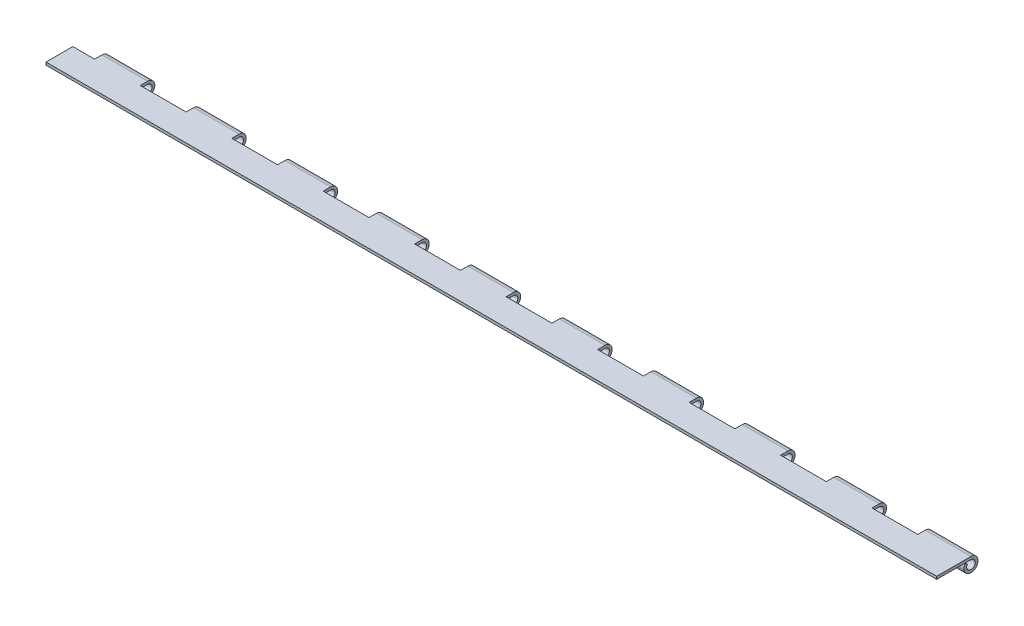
SolidWorks part; units mm, degrees
ref_plane "Front" through (0, 0, 0) normal (0, 0, 1) x (1, 0, 0)
ref_plane "Top" through (0, 0, 0) normal (0, 1, 0) x (1, 0, 0)
ref_plane "Right" through (0, 0, 0) normal (1, 0, 0) x (0, 0, -1)
sketch "Sketch1" plane through (0, 0, 0) normal (1, 0, 0) x (0, 0, -1)
  line L0 (-4.0946, 2.4711) -> (-6.7042, 4.046)
  line L1 (-6.2004, 4.7825) -> (0, 4.7825)
  line L2 (0, 7.8305) -> (-38.1, 7.8305)
  line L3 (-6.2004, 4.7825) -> (-38.1, 4.7825)
  line L4 (-38.1, 4.7825) -> (-38.1, 7.8305)
  arc A1 (-4.0946, 2.4711) -> (0, 4.7825) centre (0, 0) ccw
  arc A2 (-6.7042, 4.046) -> (0, 7.8305) centre (0, 0) ccw
  dimension "D1" = 9.565
  dimension "D2" = 38.1
extrude "Extrude1" add sketch "Sketch1" along normal blind 1219.2
sketch "Sketch2" plane through (0, 7.8305, 0) normal (0, 1, 0) x (1, 0, 0)
  line L0 (1219.2, -7.8305) -> (1219.2, 7.8305) construction
  line L1 (1168.4, 16.1474) -> (1117.473, 16.1474)
  line L2 (1168.4, 16.1474) -> (1168.4, -8.2787)
  line L3 (1168.4, -8.2787) -> (1117.473, -8.2787)
  line L4 (1117.473, 16.1474) -> (1117.473, -8.2787)
  line L5 (1219.2, 7.8305) -> (0, 7.8305) construction
  line L6 (1066.673, 16.1474) -> (1015.746, 16.1474)
  line L7 (1066.673, 16.1474) -> (1066.673, -8.2787)
  line L8 (1066.673, -8.2787) -> (1015.746, -8.2787)
  line L9 (1015.746, 16.1474) -> (1015.746, -8.2787)
  line L10 (964.946, 16.1474) -> (914.019, 16.1474)
  line L11 (964.946, 16.1474) -> (964.946, -8.2787)
  line L12 (964.946, -8.2787) -> (914.019, -8.2787)
  line L13 (914.019, 16.1474) -> (914.019, -8.2787)
  line L14 (863.219, 16.1474) -> (812.292, 16.1474)
  line L15 (863.219, 16.1474) -> (863.219, -8.2787)
  line L16 (863.219, -8.2787) -> (812.292, -8.2787)
  line L17 (812.292, 16.1474) -> (812.292, -8.2787)
  line L18 (761.492, 16.1474) -> (710.565, 16.1474)
  line L19 (761.492, 16.1474) -> (761.492, -8.2787)
  line L20 (761.492, -8.2787) -> (710.565, -8.2787)
  line L21 (710.565, 16.1474) -> (710.565, -8.2787)
  line L22 (659.765, 16.1474) -> (608.838, 16.1474)
  line L23 (659.765, 16.1474) -> (659.765, -8.2787)
  line L24 (659.765, -8.2787) -> (608.838, -8.2787)
  line L25 (608.838, 16.1474) -> (608.838, -8.2787)
  line L26 (558.038, 16.1474) -> (507.111, 16.1474)
  line L27 (558.038, 16.1474) -> (558.038, -8.2787)
  line L28 (558.038, -8.2787) -> (507.111, -8.2787)
  line L29 (507.111, 16.1474) -> (507.111, -8.2787)
  line L30 (456.311, 16.1474) -> (405.384, 16.1474)
  line L31 (456.311, 16.1474) -> (456.311, -8.2787)
  line L32 (456.311, -8.2787) -> (405.384, -8.2787)
  line L33 (405.384, 16.1474) -> (405.384, -8.2787)
  line L34 (354.584, 16.1474) -> (303.657, 16.1474)
  line L35 (354.584, 16.1474) -> (354.584, -8.2787)
  line L36 (354.584, -8.2787) -> (303.657, -8.2787)
  line L37 (303.657, 16.1474) -> (303.657, -8.2787)
  line L38 (252.857, 16.1474) -> (201.93, 16.1474)
  line L39 (252.857, 16.1474) -> (252.857, -8.2787)
  line L40 (252.857, -8.2787) -> (201.93, -8.2787)
  line L41 (201.93, 16.1474) -> (201.93, -8.2787)
  line L42 (151.13, 16.1474) -> (100.203, 16.1474)
  line L43 (151.13, 16.1474) -> (151.13, -8.2787)
  line L44 (151.13, -8.2787) -> (100.203, -8.2787)
  line L45 (100.203, 16.1474) -> (100.203, -8.2787)
  line L46 (49.403, 16.1474) -> (-1.524, 16.1474)
  line L47 (49.403, 16.1474) -> (49.403, -8.2787)
  line L48 (49.403, -8.2787) -> (-1.524, -8.2787)
  line L49 (-1.524, 16.1474) -> (-1.524, -8.2787)
  point P7 (1219.2, 7.8305)
  point P8 (1117.473, 7.8305)
  point P16 (1117.473, 7.8305)
  point P17 (1117.473, 7.8305)
  point P18 (1015.746, 7.8305)
  point P19 (1015.746, 7.8305)
  point P24 (1015.746, 7.8305)
  point P25 (914.019, 7.8305)
  point P30 (914.019, 7.8305)
  point P31 (914.019, 7.8305)
  point P32 (812.292, 7.8305)
  point P33 (812.292, 7.8305)
  point P38 (812.292, 7.8305)
  point P39 (710.565, 7.8305)
  point P44 (710.565, 7.8305)
  point P45 (710.565, 7.8305)
  point P46 (608.838, 7.8305)
  point P47 (608.838, 7.8305)
  point P52 (608.838, 7.8305)
  point P53 (507.111, 7.8305)
  point P58 (507.111, 7.8305)
  point P59 (507.111, 7.8305)
  point P60 (405.384, 7.8305)
  point P61 (405.384, 7.8305)
  point P66 (405.384, 7.8305)
  point P67 (303.657, 7.8305)
  point P72 (303.657, 7.8305)
  point P73 (303.657, 7.8305)
  point P74 (201.93, 7.8305)
  point P75 (201.93, 7.8305)
  point P80 (201.93, 7.8305)
  point P81 (100.203, 7.8305)
  point P86 (100.203, 7.8305)
  point P87 (100.203, 7.8305)
  point P88 (-1.524, 7.8305)
  point P89 (-1.524, 7.8305)
  point P94 (-1.524, 7.8305)
  dimension "D1" = 50.8
  dimension "D2" = 50.927
extrude "Cut-Extrude1" cut sketch "Sketch2" against normal through all
sketch "Sketch3" plane through (0, 7.8305, 0) normal (0, 1, 0) x (1, 0, 0)
  line L0 (1219.2, 0) -> (1219.2, -38.1) construction
  line L1 (-22.1956, 35.9637) -> (228.6, 35.9637)
  line L2 (-22.1956, 35.9637) -> (-22.1956, -77.9128)
  line L3 (-22.1956, -77.9128) -> (228.6, -77.9128)
  line L4 (228.6, 35.9637) -> (228.6, -77.9128)
  dimension "D1" = 990.6
extrude "Cut-Extrude2" cut sketch "Sketch3" against normal through all
